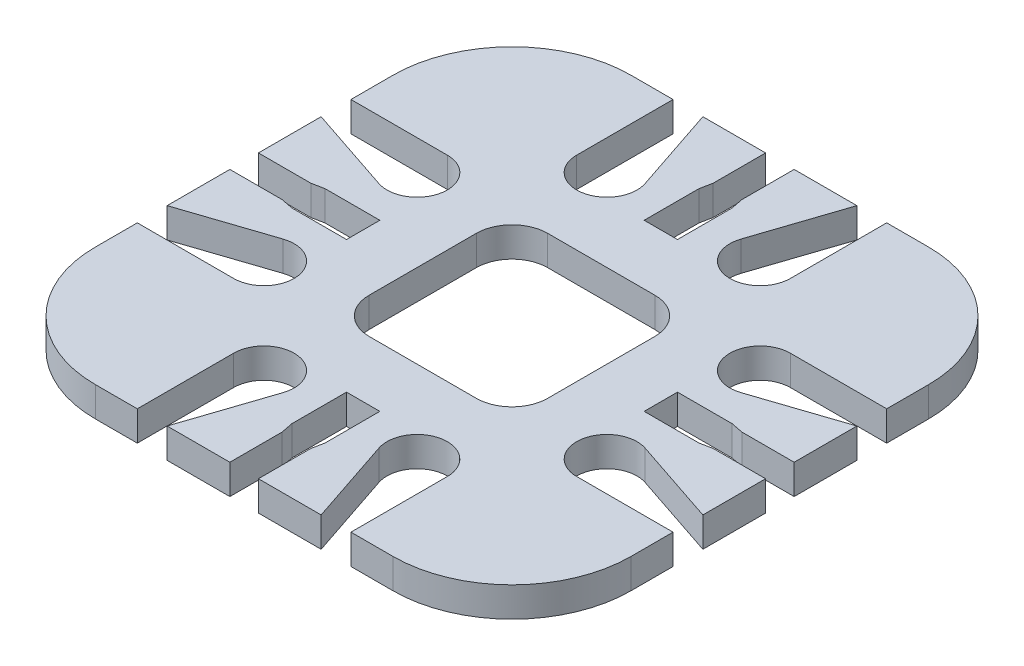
SolidWorks part; units mm, degrees
ref_plane "Front Plane" through (0, 0, 0) normal (0, 0, 1) x (1, 0, 0)
ref_plane "Top Plane" through (0, 0, 0) normal (0, 1, 0) x (1, 0, 0)
ref_plane "Right Plane" through (0, 0, 0) normal (1, 0, 0) x (0, 0, -1)
sketch "Sketch1" plane through (0, 0, 0) normal (0, 1, 0) x (1, 0, 0)
  line L0 (0, 25.2446) -> (0, -22.9639) construction
  line L1 (-42.3418, 0) -> (43.5214, 0) construction
  line L2 (1.2, -22.5) -> (1.2, -18.1)
  line L3 (-12.5, 22.5) -> (-8.973, 22.5)
  line L4 (-22.5, 12.5) -> (-22.5, 8.973)
  line L5 (-12.5, -22.5) -> (-8.973, -22.5)
  line L6 (22.5, 12.5) -> (22.5, 8.973)
  line L7 (-1.4, -17.1) -> (-1.2, -18.1)
  line L8 (1.4, -17.1) -> (1.4, -12.5)
  line L9 (1.4, -12.5) -> (-1.4, -12.5)
  line L10 (-1.4, -12.5) -> (-1.4, -17.1)
  line L11 (-6.468, -22.5) -> (-4.0308, -15.2083)
  line L12 (-1.2, -18.1) -> (-1.2, -22.5)
  line L13 (1.4, -17.1) -> (1.2, -18.1)
  line L14 (-4.5, 7.5) -> (4.5, 7.5)
  line L15 (-7.5, 4.5) -> (-7.5, -4.5)
  line L16 (-4.5, -7.5) -> (4.5, -7.5)
  line L17 (7.5, 4.5) -> (7.5, -4.5)
  line L18 (-8.973, -22.5) -> (-8.973, -14.4042)
  line L19 (8.973, -22.5) -> (8.973, -14.4042)
  line L20 (6.468, -22.5) -> (4.0308, -15.2083)
  line L21 (-22.5, -1.2) -> (-18.1, -1.2)
  line L22 (-17.1, 1.4) -> (-18.1, 1.2)
  line L23 (-17.1, -1.4) -> (-12.5, -1.4)
  line L24 (-12.5, -1.4) -> (-12.5, 1.4)
  line L25 (-12.5, 1.4) -> (-17.1, 1.4)
  line L26 (-22.5, 6.468) -> (-15.2083, 4.0308)
  line L27 (-18.1, 1.2) -> (-22.5, 1.2)
  line L28 (-17.1, -1.4) -> (-18.1, -1.2)
  line L29 (-22.5, 8.973) -> (-14.4042, 8.973)
  line L30 (-22.5, -8.973) -> (-14.4042, -8.973)
  line L31 (-22.5, -6.468) -> (-15.2083, -4.0308)
  line L32 (-1.2, 22.5) -> (-1.2, 18.1)
  line L33 (1.4, 17.1) -> (1.2, 18.1)
  line L34 (-1.4, 17.1) -> (-1.4, 12.5)
  line L35 (-1.4, 12.5) -> (1.4, 12.5)
  line L36 (1.4, 12.5) -> (1.4, 17.1)
  line L37 (6.468, 22.5) -> (4.0308, 15.2083)
  line L38 (1.2, 18.1) -> (1.2, 22.5)
  line L39 (-1.4, 17.1) -> (-1.2, 18.1)
  line L40 (8.973, 22.5) -> (8.973, 14.4042)
  line L41 (-8.973, 22.5) -> (-8.973, 14.4042)
  line L42 (-6.468, 22.5) -> (-4.0308, 15.2083)
  line L43 (22.5, 1.2) -> (18.1, 1.2)
  line L44 (17.1, -1.4) -> (18.1, -1.2)
  line L45 (17.1, 1.4) -> (12.5, 1.4)
  line L46 (12.5, 1.4) -> (12.5, -1.4)
  line L47 (12.5, -1.4) -> (17.1, -1.4)
  line L48 (22.5, -6.468) -> (15.2083, -4.0308)
  line L49 (18.1, -1.2) -> (22.5, -1.2)
  line L50 (17.1, 1.4) -> (18.1, 1.2)
  line L51 (22.5, -8.973) -> (14.4042, -8.973)
  line L52 (22.5, 8.973) -> (14.4042, 8.973)
  line L53 (22.5, 6.468) -> (15.2083, 4.0308)
  line L54 (-22.5, 6.468) -> (-22.5, 1.2)
  line L55 (-22.5, -8.973) -> (-22.5, -12.5)
  line L56 (-6.468, -22.5) -> (-1.2, -22.5)
  line L57 (8.973, -22.5) -> (12.5, -22.5)
  line L58 (22.5, -8.973) -> (22.5, -12.5)
  line L59 (22.5, 6.468) -> (22.5, 1.2)
  line L60 (8.973, 22.5) -> (12.5, 22.5)
  line L61 (-6.468, 22.5) -> (-1.2, 22.5)
  line L62 (1.2, 22.5) -> (6.468, 22.5)
  line L63 (-22.5, -1.2) -> (-22.5, -6.468)
  line L64 (22.5, -1.2) -> (22.5, -6.468)
  line L65 (1.2, -22.5) -> (6.468, -22.5)
  line L66 (-3.9, -14.4042) -> (-3.9, -10.0318) construction
  arc A0 (-4.5, 7.5) -> (-7.5, 4.5) centre (-4.5, 4.5) ccw
  arc A1 (4.5, 7.5) -> (7.5, 4.5) centre (4.5, 4.5) cw
  arc A2 (4.5, -7.5) -> (7.5, -4.5) centre (4.5, -4.5) ccw
  arc A3 (-7.5, -4.5) -> (-4.5, -7.5) centre (-4.5, -4.5) ccw
  arc A4 (-4.0308, -15.2083) -> (-8.973, -14.4042) centre (-6.4365, -14.4042) ccw
  arc A5 (4.0308, -15.2083) -> (8.973, -14.4042) centre (6.4365, -14.4042) cw
  arc A6 (-15.2083, 4.0308) -> (-14.4042, 8.973) centre (-14.4042, 6.4365) ccw
  arc A7 (-15.2083, -4.0308) -> (-14.4042, -8.973) centre (-14.4042, -6.4365) cw
  arc A8 (4.0308, 15.2083) -> (8.973, 14.4042) centre (6.4365, 14.4042) ccw
  arc A9 (-4.0308, 15.2083) -> (-8.973, 14.4042) centre (-6.4365, 14.4042) cw
  arc A10 (15.2083, -4.0308) -> (14.4042, -8.973) centre (14.4042, -6.4365) ccw
  arc A11 (15.2083, 4.0308) -> (14.4042, 8.973) centre (14.4042, 6.4365) cw
  arc A12 (-12.5, 22.5) -> (-22.5, 12.5) centre (-12.5, 12.5) ccw
  arc A13 (12.5, 22.5) -> (22.5, 12.5) centre (12.5, 12.5) cw
  arc A14 (12.5, -22.5) -> (22.5, -12.5) centre (12.5, -12.5) ccw
  arc A15 (-22.5, -12.5) -> (-12.5, -22.5) centre (-12.5, -12.5) ccw
  point P96 (0, 0)
  dimension "D8" = 3
  dimension "D11" = 10
  dimension "D2" = 45
  dimension "D3" = 2.4
  dimension "D4" = 0.2
  dimension "D5" = 10
  dimension "D6" = 5.4
  dimension "D7" = 15
  dimension "D9" = 1
  dimension "D12" = 4.6
  dimension "D13" = 2.5
  dimension "D10" = 4
extrude "Boss-Extrude1" add sketch "Sketch1" along normal blind 2.5
